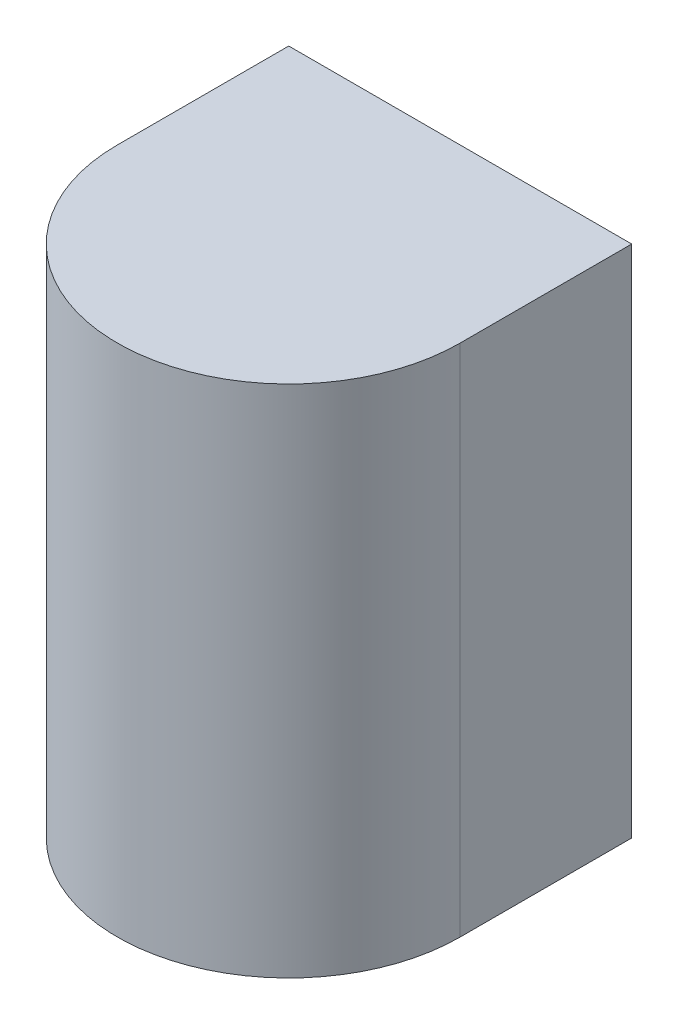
SolidWorks part; units mm, degrees
ref_plane "Front Plane" through (0, 0, 0) normal (0, 0, 1) x (1, 0, 0)
ref_plane "Top Plane" through (0, 0, 0) normal (0, 1, 0) x (1, 0, 0)
ref_plane "Right Plane" through (0, 0, 0) normal (1, 0, 0) x (0, 0, -1)
sketch "Sketch1" plane through (0, 0, 0) normal (0, 1, 0) x (1, 0, 0)
  line L0 (101.6, 101.6) -> (-101.6, 101.6)
  line L1 (-101.6, 101.6) -> (-101.6, 0)
  line L2 (101.6, 101.6) -> (101.6, 0)
  arc A0 (-101.6, 0) -> (101.6, 0) centre (0, 0) ccw
extrude "Boss-Extrude1" add sketch "Sketch1" against normal blind 304.8
sketch "Sketch2" plane through (0, -304.8, 0) normal (0, -1, 0) x (1, 0, 0)
  circle A0 centre (0, 0) radius 12.7
  circle A1 centre (0, 0) radius 20.32
  dimension "D1" = 7.62
extrude "Boss-Extrude2" add sketch "Sketch2" along normal blind 16.764
